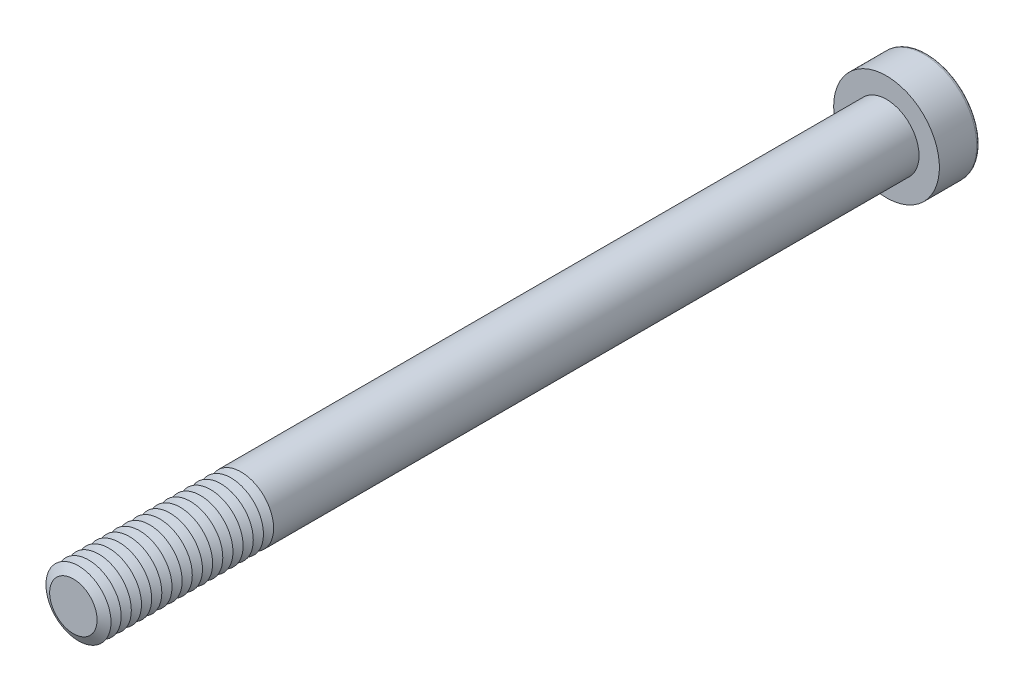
SolidWorks part; units mm, degrees
ref_plane "Front Plane" through (0, 0, 0) normal (0, 0, 1) x (1, 0, 0)
ref_plane "Top Plane" through (0, 0, 0) normal (0, 1, 0) x (1, 0, 0)
ref_plane "Right Plane" through (0, 0, 0) normal (1, 0, 0) x (0, 0, -1)
sketch "Sketch1" plane through (0, 0, 0) normal (0, 0, 1) x (1, 0, 0)
  circle A0 centre (0, 0) radius 4
  dimension "D1" = 8
extrude "Boss-Extrude1" add sketch "Sketch1" along normal blind 100
sketch "Sketch2" plane through (0, 0, 0) normal (0, 0, -1) x (-1, 0, 0)
  circle A0 centre (0, 0) radius 6.5
  dimension "D1" = 13
extrude "Boss-Extrude2" add sketch "Sketch2" along normal blind 5
sketch "Sketch3" plane through (0, 0, -5) normal (0, 0, -1) x (-1, 0, 0)
  line L1 (-1.4434, 2.5) -> (-2.8868, 0)
  line L2 (-2.8868, 0) -> (-1.4434, -2.5)
  line L3 (-1.4434, -2.5) -> (1.4434, -2.5)
  line L4 (1.4434, -2.5) -> (2.8868, 0)
  line L5 (2.8868, 0) -> (1.4434, 2.5)
  line L6 (1.4434, 2.5) -> (-1.4434, 2.5)
  circle A0 centre (0, 0) radius 2.5 construction
  dimension "D1" = 5
extrude "Cut-Extrude1" cut sketch "Sketch3" against normal blind 3.75
fillet "Fillet1" radius 0.4 1 edges at (-6.5, 0, -5)
sketch "Sketch4" plane through (0, 0, -1.25) normal (0, 0, -1) x (-1, 0, 0)
  line L0 (1.4434, -2.5) -> (2.8868, 0) construction
  circle A0 centre (0, 0) radius 2.5
extrude "Cut-Extrude2" cut sketch "Sketch4" against normal through all draft 60
sketch "Sketch5" plane through (0, 0, -5) normal (0, 0, -1) x (-1, 0, 0)
  circle A0 centre (0, 0) radius 2.8868
extrude "Cut-Extrude3" cut sketch "Sketch5" against normal through all draft 75
sketch "Sketch7" plane through (0, 0, 0) normal (1, 0, 0) x (0, 0, -1)
  line L25 (-100, 2.9175) -> (-99.375, 4)
  line L26 (-100, 4) -> (-100, -4) construction
  line L27 (-99.375, 4) -> (-100.625, 4)
  line L28 (-100.625, 4) -> (-100, 2.9175)
  line L29 (0, 4) -> (-100, 4) construction
  dimension "D1" = 1.25
revolve "Cut-Revolve1" cut sketch "Sketch7" angle 360 about axis through (0, 0, 100) along (0, 0, -1)
pattern_linear "LPattern1" count 17 spacing 1.25 along (0, 0, -1) of "Cut-Revolve1"
